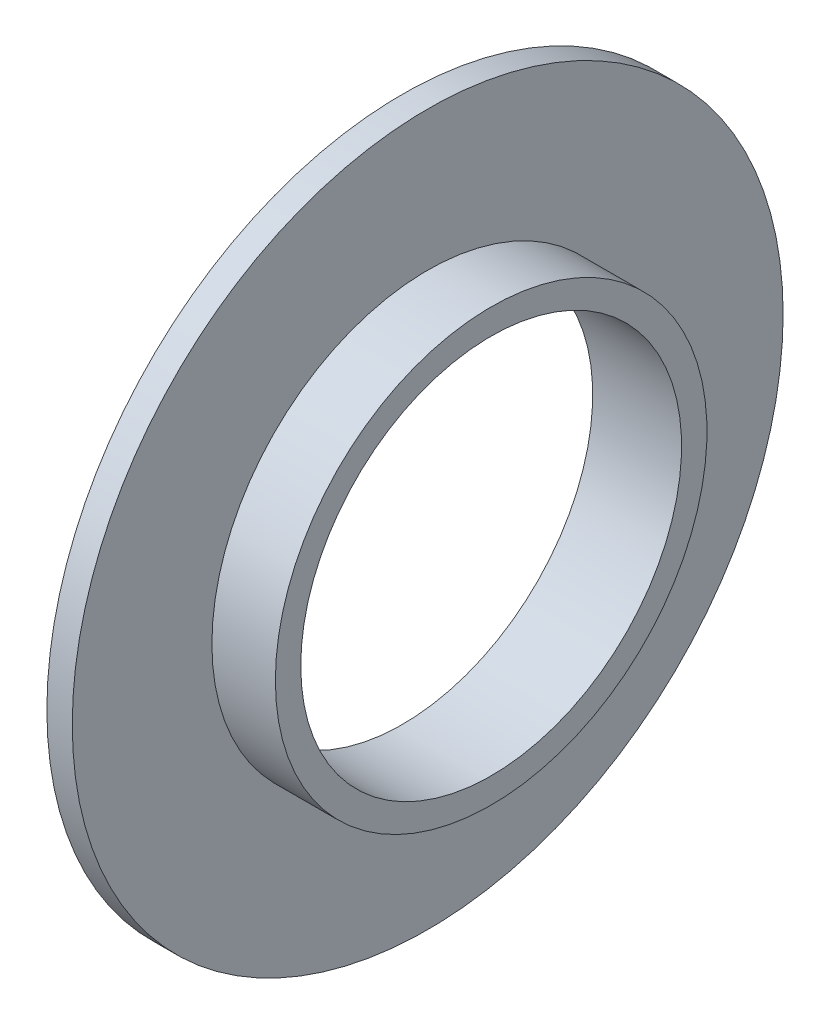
SolidWorks part; units mm, degrees
ref_plane "Plan de face" through (0, 0, 0) normal (0, 0, 1) x (1, 0, 0)
ref_plane "Plan de dessus" through (0, 0, 0) normal (0, 1, 0) x (1, 0, 0)
ref_plane "Plan de droite" through (0, 0, 0) normal (1, 0, 0) x (0, 0, -1)
sketch "Esquisse1" plane through (0, 0, 0) normal (0, 1, 0) x (1, 0, 0)
  line L0 (-8.2377, 0) -> (12.8279, 0) construction
  line L4 (-0.3115, 8.5) -> (-2.8115, 8.5)
  line L5 (-2.8115, 8.5) -> (-2.8115, 14)
  line L6 (-2.8115, 14) -> (-3.8115, 14)
  line L7 (-3.8115, 14) -> (-3.8115, 0)
  line L8 (-3.8115, 0) -> (-1.9057, 0)
  line L9 (-0.3115, 8.5) -> (-0.3115, 7.5)
  line L10 (-0.3115, 7.5) -> (-1.9057, 7.5)
  line L11 (-1.9057, 7.5) -> (-1.9057, 0)
  dimension "D1" = 7.5
  dimension "D2" = 8.5
  dimension "D3" = 14
  dimension "D4" = 2.5
  dimension "D5" = 1
revolve "Révolution1" add sketch "Esquisse1" angle 360 about L0
sketch "Esquisse2" plane through (-3.8115, 0, 0) normal (-1, 0, 0) x (0, 0, 1)
  circle A0 centre (0, 0) radius 7.5
  dimension "D1" = 15
extrude "Enlèv. mat.-Extru.1" cut sketch "Esquisse2" against normal through all
